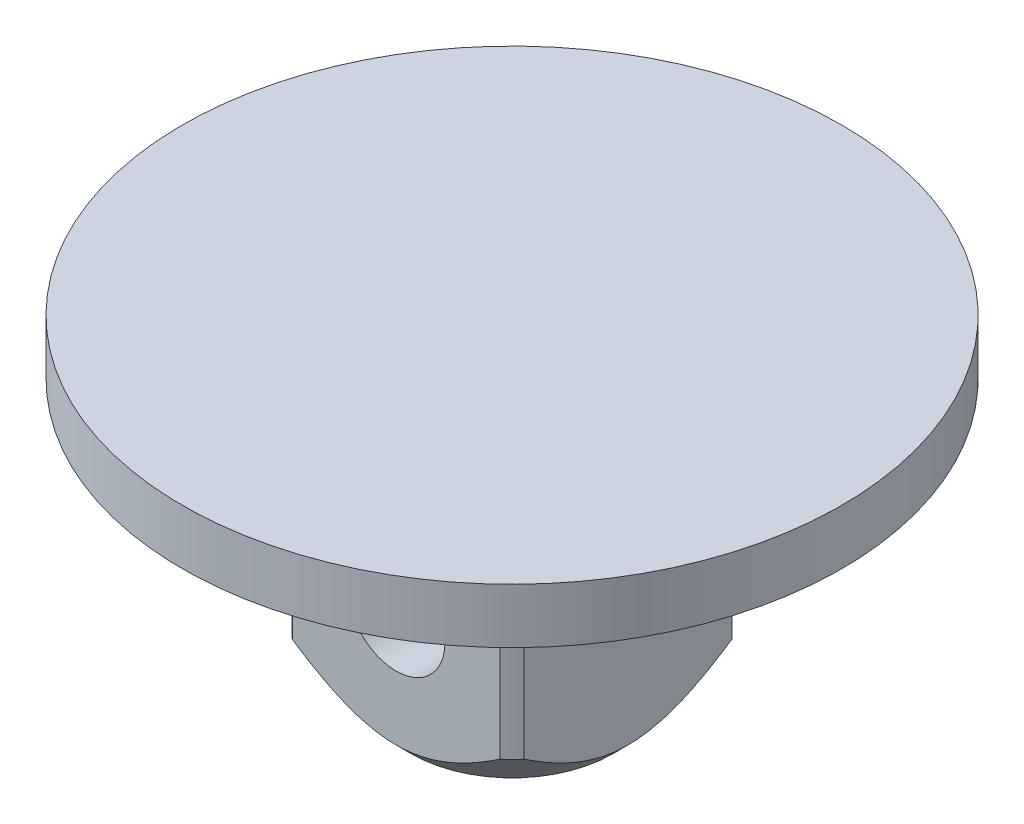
SolidWorks part; units mm, degrees
ref_plane "Plan de face" through (0, 0, 0) normal (0, 0, 1) x (1, 0, 0)
ref_plane "Plan de dessus" through (0, 0, 0) normal (0, 1, 0) x (1, 0, 0)
ref_plane "Plan de droite" through (0, 0, 0) normal (1, 0, 0) x (0, 0, -1)
sketch "Esquisse1" plane through (0, 0, 0) normal (0, 0, 1) x (1, 0, 0)
  line L0 (0, 0) -> (0, 12.0912) construction
  line L1 (0, 4.5) -> (27, 4.5)
  line L2 (27, 4.5) -> (27, 0)
  line L3 (27, 0) -> (12.75, 0)
  line L4 (12.75, 0) -> (12.75, -22.5)
  line L5 (12.75, -22.5) -> (0, -22.5)
  line L6 (0, -22.5) -> (0, 4.5)
  dimension "D1" = 54
  dimension "D2" = 25.5
  dimension "D3" = 4.5
  dimension "D4" = 22.5
revolve "Révolution1" add sketch "Esquisse1" angle 360 about L0
chamfer "Chanfrein1" distance 4.5 angle 45 1 edges at (0, -22.5, -12.75)
sketch "Esquisse2" plane through (0, -22.5, 0) normal (0, -1, 0) x (1, 0, 0)
  line L1 (-9.5, 9.5) -> (9.5, 9.5)
  line L2 (-9.5, 9.5) -> (-9.5, -9.5)
  line L3 (-9.5, -9.5) -> (9.5, -9.5)
  line L4 (9.5, 9.5) -> (9.5, -9.5)
  line L5 (-9.5, 9.5) -> (9.5, -9.5) construction
  line L6 (-9.5, -9.5) -> (9.5, 9.5) construction
  point P0 (0, 0)
  dimension "D1" = 19
extrude "Enlèv. mat.-Extru.1" cut sketch "Esquisse2" against normal blind 21 flip side to cut
hole_wizard "Diamètre du perçage Ø8.0 (8)1" positions "Esquisse5" profile "Esquisse4" hole size "Ø8.0" standard "ISO"
sketch "Esquisse5" plane through (0, 0, 9.5) normal (0, 0, 1) x (1, 0, 0)
  point P0 (0, -12)
  dimension "D1" = 12
sketch "Esquisse4" plane through (0, -12, 9.5) normal (1, 0, 0) x (0, -1, 0)
  line L0 (0, 0) -> (0, 15.4034)
  line L1 (0, 15.4034) -> (4, 13)
  line L2 (4, 13) -> (4, 0)
  line L5 (4, 0) -> (0, 0)
  line L10 (0, 15.4034) -> (-4, 13) construction
  line L11 (0, -6.35) -> (0, 107.95) construction
  dimension "Diamètre du perçage" = 8
  dimension "Profondeur du perçage" = 13
  dimension "Angle de pointe" = 118
